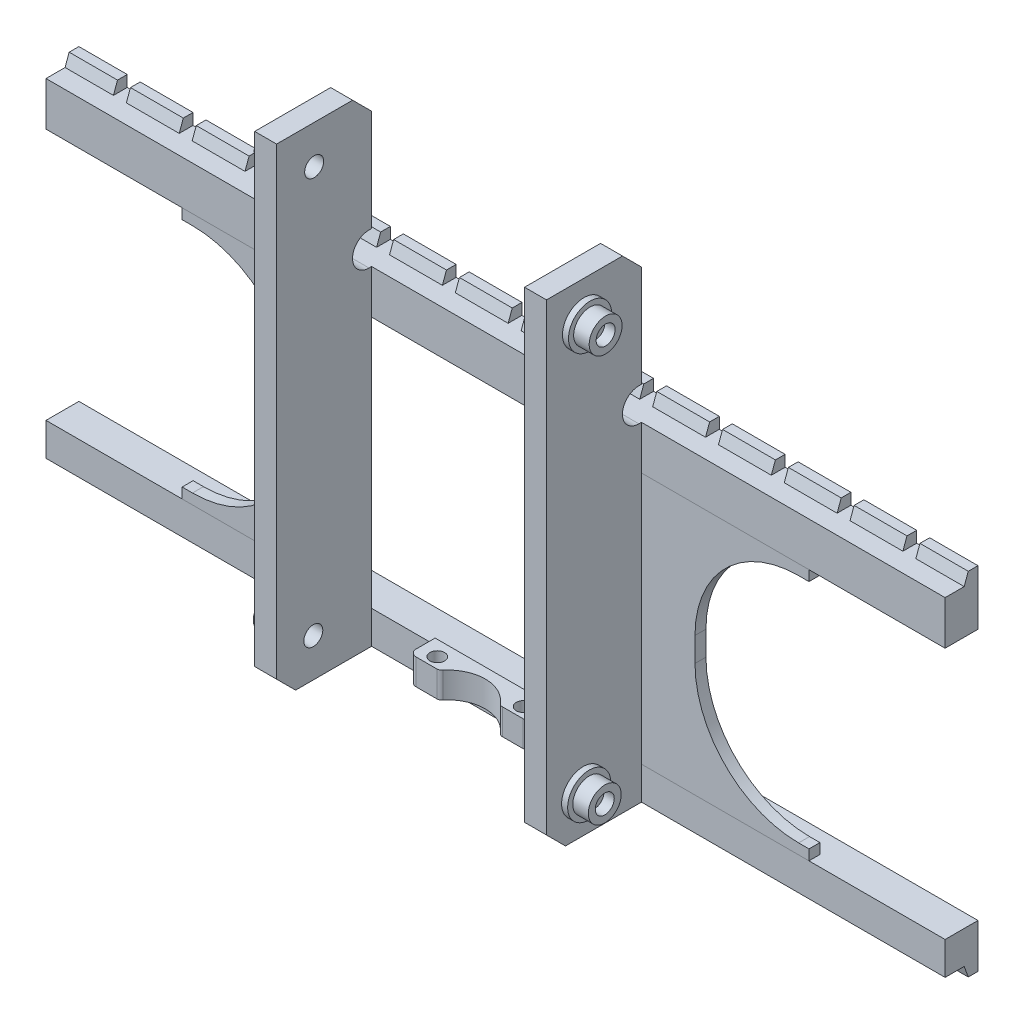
SolidWorks part; units mm, degrees
ref_plane "Front Plane" through (0, 0, 0) normal (0, 0, 1) x (1, 0, 0)
ref_plane "Top Plane" through (0, 0, 0) normal (0, 1, 0) x (1, 0, 0)
ref_plane "Right Plane" through (0, 0, 0) normal (1, 0, 0) x (0, 0, -1)
sketch "Sketch2" plane through (0, 0, 0) normal (0, 1, 0) x (1, 0, 0)
  line L0 (0, 0) -> (0, -166.4194) construction
  line L1 (143.6, 41) -> (169, 41)
  line L2 (143.6, 41) -> (143.6, 151)
  line L3 (143.6, 151) -> (169, 151)
  line L4 (169, 41) -> (169, 151)
  line L5 (-143.6, 151) -> (-169, 151)
  line L6 (-169, 41) -> (-169, 151)
  line L7 (-143.6, 41) -> (-169, 41)
  line L8 (-143.6, 41) -> (-143.6, 151)
extrude "Boss-Extrude1" add sketch "Sketch2" along normal blind 558.8
sketch "Sketch3" plane through (0, 0, 0) normal (1, 0, 0) x (0, 0, -1)
  line L0 (151, 558.8) -> (151, 0) construction
  line L1 (151, 558.8) -> (151, 0) construction
  line L2 (151, 0) -> (151, 38.1)
  line L3 (151, 38.1) -> (189.1, 38.1)
  line L4 (189.1, 38.1) -> (189.1, -13)
  line L5 (189.1, -13) -> (177.8316, -13)
  line L6 (177.8316, -13) -> (173.1, 0)
  line L7 (0, 0) -> (263.9397, 0) construction
  line L8 (173.1, 0) -> (151, 0)
  dimension "D1" = 110
  dimension "D2" = 16
  dimension "D3" = 38.1
  dimension "D4" = 13
  dimension "D5" = 38.1
extrude "Boss-Extrude2" add sketch "Sketch3" along normal mid plane 1041.4
sketch "Sketch4" plane through (0, 0, 0) normal (1, 0, 0) x (0, 0, -1)
  line L0 (151, 38.1) -> (151, 330.2)
  line L1 (151, 330.2) -> (189.1, 330.2)
  line L2 (189.1, 330.2) -> (189.1, 394)
  line L3 (189.1, 394) -> (177.8316, 394)
  line L4 (177.8316, 394) -> (173.1, 381)
  line L5 (173.1, 381) -> (151, 381)
  line L6 (151, 38.1) -> (151, 0)
  line L7 (189.1, 38.1) -> (151, 38.1)
  line L8 (189.1, -13) -> (189.1, 38.1)
  line L9 (177.8316, -13) -> (189.1, -13)
  line L10 (173.1, 0) -> (177.8316, -13)
  line L11 (151, 0) -> (173.1, 0)
  line L12 (151, 38.1) -> (151, 0) construction
  line L13 (189.1, 38.1) -> (151, 38.1) construction
  line L14 (189.1, -13) -> (189.1, 38.1) construction
  line L15 (177.8316, -13) -> (189.1, -13) construction
  line L16 (173.1, 0) -> (177.8316, -13) construction
  line L17 (151, 0) -> (173.1, 0) construction
  line L18 (151, 381) -> (151, 330.2)
  dimension "D2" = 16
  dimension "D3" = 13
  dimension "D4" = 110
  dimension "D5" = 50.8
  dimension "D6" = 381
  dimension "D1" = 0
extrude "Boss-Extrude3" add sketch "Sketch4" along normal mid plane 1041.4 contours L5 L18 L1 L2 L3 L4
sketch "Sketch5" plane through (143.6, 0, 0) normal (-1, 0, 0) x (0, 0, 1)
  line L0 (-151, 381) -> (-148, 381)
  line L1 (-148, 381) -> (-148, 400.05) construction
  line L2 (-148, 419.1) -> (-151, 419.1)
  line L3 (-151, 558.8) -> (-151, 381) construction
  line L4 (-151, 419.1) -> (-151, 381)
  arc A0 (-148, 381) -> (-148, 419.1) centre (-148, 400.05) ccw
  dimension "D1" = 3
  dimension "D2" = 19.05
extrude "Cut-Extrude1" cut sketch "Sketch5" against normal blind 30 and the other way blind 320
sketch "Sketch6" plane through (0, 0, -151) normal (0, 0, -1) x (-1, 0, 0)
  line L0 (163, 330.2) -> (363, 330.2)
  line L1 (143.6, 330.2) -> (169, 330.2) construction
  line L2 (169, 330.2) -> (520.7, 330.2) construction
  line L3 (363, 330.2) -> (363, 318.2)
  line L4 (363, 318.2) -> (351, 318.2)
  line L5 (163, 330.2) -> (163, 38.1)
  line L6 (143.6, 38.1) -> (169, 38.1) construction
  line L7 (163, 38.1) -> (363, 38.1)
  line L8 (169, 38.1) -> (520.7, 38.1) construction
  line L9 (363, 38.1) -> (363, 50.1)
  line L10 (363, 50.1) -> (351, 50.1)
  line L11 (231, 198.2) -> (231, 170.1)
  line L12 (169, 330.2) -> (169, 38.1) construction
  line L13 (0, 0) -> (0, 101.5131) construction
  line L14 (-363, 318.2) -> (-351, 318.2)
  line L15 (-363, 330.2) -> (-363, 318.2)
  line L16 (-163, 330.2) -> (-363, 330.2)
  line L17 (-163, 330.2) -> (-163, 38.1)
  line L18 (-163, 38.1) -> (-363, 38.1)
  line L19 (-363, 38.1) -> (-363, 50.1)
  line L20 (-363, 50.1) -> (-351, 50.1)
  line L21 (-231, 198.2) -> (-231, 170.1)
  arc A0 (351, 318.2) -> (231, 198.2) centre (351, 198.2) ccw
  arc A1 (351, 50.1) -> (231, 170.1) centre (351, 170.1) cw
  arc A2 (-351, 318.2) -> (-231, 198.2) centre (-351, 198.2) cw
  arc A3 (-351, 50.1) -> (-231, 170.1) centre (-351, 170.1) ccw
  dimension "D1" = 12
  dimension "D4" = 120
  dimension "D2" = 200
  dimension "D3" = 6
  dimension "D5" = 12
extrude "Boss-Extrude4" add sketch "Sketch6" along normal blind 12.7
sketch "Sketch7" plane through (0, 0, -189.1) normal (0, 0, -1) x (-1, 0, 0)
  line L0 (-520.7, 394) -> (520.7, 394) construction
  line L1 (464.7, 394) -> (449.7, 394)
  line L2 (464.7, 394) -> (464.7, 381)
  line L3 (464.7, 381) -> (449.7, 381)
  line L4 (449.7, 394) -> (449.7, 381)
  line L5 (457.2, 394) -> (457.2, 408.4838) construction
  line L6 (0, 0) -> (0, 427.4582) construction
  line L7 (388.5, 394) -> (388.5, 381)
  line L8 (388.5, 394) -> (373.5, 394)
  line L9 (373.5, 394) -> (373.5, 381)
  line L10 (388.5, 381) -> (373.5, 381)
  line L11 (312.3, 394) -> (312.3, 381)
  line L12 (312.3, 394) -> (297.3, 394)
  line L13 (297.3, 394) -> (297.3, 381)
  line L14 (312.3, 381) -> (297.3, 381)
  line L15 (236.1, 394) -> (236.1, 381)
  line L16 (236.1, 394) -> (221.1, 394)
  line L17 (221.1, 394) -> (221.1, 381)
  line L18 (236.1, 381) -> (221.1, 381)
  line L19 (159.9, 394) -> (159.9, 381)
  line L20 (159.9, 394) -> (144.9, 394)
  line L21 (144.9, 394) -> (144.9, 381)
  line L22 (159.9, 381) -> (144.9, 381)
  line L23 (83.7, 394) -> (83.7, 381)
  line L24 (83.7, 394) -> (68.7, 394)
  line L25 (68.7, 394) -> (68.7, 381)
  line L26 (83.7, 381) -> (68.7, 381)
  line L27 (7.5, 394) -> (7.5, 381)
  line L28 (7.5, 394) -> (-7.5, 394)
  line L29 (-7.5, 394) -> (-7.5, 381)
  line L30 (7.5, 381) -> (-7.5, 381)
  line L31 (-68.7, 394) -> (-68.7, 381)
  line L32 (-68.7, 394) -> (-83.7, 394)
  line L33 (-83.7, 394) -> (-83.7, 381)
  line L34 (-68.7, 381) -> (-83.7, 381)
  line L35 (-144.9, 394) -> (-144.9, 381)
  line L36 (-144.9, 394) -> (-159.9, 394)
  line L37 (-159.9, 394) -> (-159.9, 381)
  line L38 (-144.9, 381) -> (-159.9, 381)
  line L39 (-221.1, 394) -> (-221.1, 381)
  line L40 (-221.1, 394) -> (-236.1, 394)
  line L41 (-236.1, 394) -> (-236.1, 381)
  line L42 (-221.1, 381) -> (-236.1, 381)
  line L43 (-297.3, 394) -> (-297.3, 381)
  line L44 (-297.3, 394) -> (-312.3, 394)
  line L45 (-312.3, 394) -> (-312.3, 381)
  line L46 (-297.3, 381) -> (-312.3, 381)
  line L47 (-373.5, 394) -> (-373.5, 381)
  line L48 (-373.5, 394) -> (-388.5, 394)
  line L49 (-388.5, 394) -> (-388.5, 381)
  line L50 (-373.5, 381) -> (-388.5, 381)
  line L51 (-449.7, 394) -> (-449.7, 381)
  line L52 (-449.7, 394) -> (-464.7, 394)
  line L53 (-464.7, 394) -> (-464.7, 381)
  line L54 (-449.7, 381) -> (-464.7, 381)
  line L55 (-520.7, -13) -> (520.7, -13) construction
  line L56 (90, -13) -> (10, -13)
  line L57 (90, -13) -> (90, 0)
  line L58 (90, 0) -> (10, 0)
  line L59 (10, -13) -> (10, 0)
  dimension "D1" = 13
  dimension "D2" = 15
  dimension "D3" = 457.2
  dimension "D5" = 13
  dimension "D6" = 80
  dimension "D7" = 10
  dimension "D4" = 13
extrude "Cut-Extrude2" cut sketch "Sketch7" against normal blind 25
sketch "Sketch8" plane through (169, 0, 0) normal (1, 0, 0) x (0, 0, -1)
  line L0 (123, 0) -> (45, 0) construction
  line L1 (123, 0) -> (45, 0) construction
  line L2 (84, 0) -> (84, 558.8) construction
  line L3 (83.5, 0) -> (83.5, 44.45) construction
  line L5 (41, 558.8) -> (151, 558.8) construction
  line L6 (84.5, 558.8) -> (84.5, 514.35) construction
  circle A0 centre (83.5, 44.45) radius 19.05
  circle A1 centre (84.5, 514.35) radius 19.05
  point P13 (89.8516, 508)
  dimension "D5" = 38.1
  dimension "D2" = 0.5
  dimension "D3" = 44.45
  dimension "D4" = 0.5
  dimension "D6" = 44.45
extrude "Boss-Extrude5" add sketch "Sketch8" against normal up to surface (25 mm away) from offset 25 separate body
sketch "Sketch12" plane through (169, 0, 0) normal (-1, 0, 0) x (0, 0, 1)
  circle A0 centre (-84.5, 514.35) radius 25
  circle A1 centre (-83.5, 44.45) radius 25
  dimension "D1" = 50
  dimension "D2" = 50
extrude "Boss-Extrude9" add sketch "Sketch12" against normal blind 7
sketch "Sketch13" plane through (194, 0, 0) normal (1, 0, 0) x (0, 0, -1)
  circle A0 centre (84.5, 514.35) radius 11
  circle A1 centre (83.5, 44.45) radius 11
  dimension "D1" = 22
  dimension "D2" = 22
extrude "Cut-Extrude3" cut sketch "Sketch13" against normal blind 12
sketch "Sketch14" plane through (182, 0, 0) normal (1, 0, 0) x (0, 0, -1)
  circle A0 centre (84.5, 514.35) radius 6
  circle A1 centre (83.5, 44.45) radius 6
  dimension "D1" = 12
  dimension "D2" = 12
extrude "Cut-Extrude4" cut sketch "Sketch14" against normal up to next (13 mm away)
mirror "Mirror1" about plane through (0, 0, 0) normal (1, 0, 0)
chamfer "Chamfer1" distance 22 angle 45 2 edges at (-156.3, 558.8, -151) (156.3, 558.8, -151)
sketch "Sketch15" plane through (169, 0, 0) normal (1, 0, 0) x (0, 0, -1)
  circle A0 centre (84.5, 514.35) radius 11 construction
  circle A1 centre (84.5, 514.35) radius 11
  circle A2 centre (83.5, 44.45) radius 11 construction
  circle A3 centre (83.5, 44.45) radius 11
extrude "Cut-Extrude5" cut sketch "Sketch15" against normal up to surface (338 mm away)
combine bodies "Combine1" operation type add bodies to combine 126 125 116 117 127
sketch "Sketch16" plane through (0, 0, -151) normal (0, 0, 1) x (1, 0, 0)
  line L1 (-363, 330.2) -> (363, 330.2)
  line L2 (-363, 330.2) -> (-363, 38.1)
  line L3 (-363, 38.1) -> (363, 38.1)
  line L4 (363, 330.2) -> (363, 38.1)
sketch "Sketch17" plane through (0, 381, 0) normal (0, 1, 0) x (1, 0, 0)
  line L0 (520.7, 151) -> (169, 151) construction
  line L1 (168, 151) -> (144.6, 151)
  line L2 (168, 151) -> (168, 150.5)
  line L3 (168, 150.5) -> (144.6, 150.5)
  line L4 (144.6, 151) -> (144.6, 150.5)
  line L5 (169, 148) -> (169, 151) construction
  line L6 (143.6, 151) -> (143.6, 148) construction
  line L7 (-169, 151) -> (-520.7, 151) construction
  line L8 (-168, 151) -> (-144.6, 151)
  line L9 (-168, 151) -> (-168, 150.5)
  line L10 (-168, 150.5) -> (-144.6, 150.5)
  line L11 (-144.6, 151) -> (-144.6, 150.5)
  line L12 (-169, 151) -> (-169, 148) construction
  line L13 (-143.6, 148) -> (-143.6, 151) construction
  dimension "D1" = 1
  dimension "D2" = 1
  dimension "D3" = 0.5
  dimension "D4" = 1
  dimension "D5" = 1
  dimension "D6" = 0.5
extrude "Cut-Extrude6" [suppressed] cut sketch "Sketch17" against normal offset from surface (49.8 mm away) 1
sketch "Sketch18" plane through (-363, 0, 0) normal (-1, 0, 0) x (0, 0, 1)
  line L0 (-163.7, 38.1) -> (-151, 38.1) construction
  line L1 (-162.7, 38.1) -> (-157.5, 38.1)
  line L2 (-162.7, 38.1) -> (-162.7, 38.6)
  line L3 (-162.7, 38.6) -> (-157.5, 38.6)
  line L4 (-157.5, 38.1) -> (-157.5, 38.6)
  line L5 (-163.7, 38.1) -> (-163.7, 50.1) construction
  line L6 (-151, 38.1) -> (-151, 50.1) construction
  line L7 (-163.7, 330.2) -> (-151, 330.2) construction
  line L8 (-162.7, 330.2) -> (-157.5, 330.2)
  line L9 (-162.7, 330.2) -> (-162.7, 329.7)
  line L10 (-162.7, 329.7) -> (-157.5, 329.7)
  line L11 (-157.5, 330.2) -> (-157.5, 329.7)
  line L12 (-163.7, 318.2) -> (-163.7, 330.2) construction
  line L13 (-151, 318.2) -> (-151, 330.2) construction
  dimension "D1" = 1
  dimension "D2" = 6.5
  dimension "D3" = 0.5
  dimension "D4" = 1
  dimension "D5" = 6.5
  dimension "D6" = 0.5
extrude "Cut-Extrude7" [suppressed] cut sketch "Sketch18" against normal through all
sketch "Sketch19" plane through (-169, 0, 0) normal (-1, 0, 0) x (0, 0, 1)
  circle A3 centre (-84.5, 514.35) radius 24
  circle A4 centre (-84.5, 514.35) radius 24
  circle A6 centre (-83.5, 44.45) radius 24
  circle A7 centre (-83.5, 44.45) radius 24
  dimension "D1" = 1
  dimension "D2" = 1
extrude "Cut-Extrude8" [suppressed] cut sketch "Sketch19" along normal blind 0.5
sketch "Sketch22" plane through (0, 0, 0) normal (0, -1, 0) x (1, 0, 0)
  line L4 (-168, -151) -> (-144.6, -151)
  line L5 (-144.6, -151) -> (-144.6, -150.5)
  line L6 (-144.6, -150.5) -> (-168, -150.5)
  line L7 (-168, -150.5) -> (-168, -151)
  line L8 (-168, -151) -> (-144.6, -151)
  line L9 (-144.6, -151) -> (-144.6, -150.5)
  line L10 (-144.6, -150.5) -> (-168, -150.5)
  line L11 (-168, -150.5) -> (-168, -151)
  line L12 (144.6, -151) -> (168, -151)
  line L13 (144.6, -150.5) -> (144.6, -151)
  line L14 (168, -150.5) -> (144.6, -150.5)
  line L15 (168, -151) -> (168, -150.5)
  line L16 (144.6, -151) -> (168, -151)
  line L17 (144.6, -150.5) -> (144.6, -151)
  line L18 (168, -150.5) -> (144.6, -150.5)
  line L19 (168, -151) -> (168, -150.5)
  dimension "D1" = 0
  dimension "D2" = 0
extrude "Cut-Extrude10" [suppressed] cut sketch "Sketch22" against normal offset from surface (37.1 mm away) 1
sketch "Sketch20" plane through (169, 0, 0) normal (1, 0, 0) x (0, 0, -1)
  circle A1 centre (83.5, 44.45) radius 24
  circle A2 centre (83.5, 44.45) radius 24
  circle A3 centre (84.5, 514.35) radius 24
  circle A4 centre (84.5, 514.35) radius 24
  dimension "D1" = 0
  dimension "D2" = 0
extrude "Cut-Extrude9" [suppressed] cut sketch "Sketch20" along normal blind 0.5
chamfer "Chamfer2" distance 22 angle 45 2 edges at (156.3, 0, -41) (-156.3, 0, -41)
chamfer "Chamfer3" [suppressed] distance 12 angle 45
chamfer "Chamfer4" [suppressed] distance 8 angle 45
chamfer "Chamfer5" [suppressed] distance 6 angle 45
chamfer "Chamfer6" [suppressed] distance 6 angle 45
chamfer "Chamfer8" [suppressed] distance 6 angle 45
sketch "Sketch23" plane through (0, 38.1, 0) normal (0, 1, 0) x (1, 0, 0)
  line L0 (-70, 151) -> (-70, 121)
  line L1 (143.6, 151) -> (-143.6, 151) construction
  line L2 (-70, 121) -> (-34.9857, 121)
  line L3 (-34.9857, 121) -> (0, 121) construction
  line L4 (0, 0) -> (0, 263.9397) construction
  line L5 (0, 121) -> (0, 151) construction
  line L6 (0, 121) -> (0, 96) construction
  line L7 (34.9857, 121) -> (70, 121)
  line L8 (70, 121) -> (70, 151)
  line L9 (143.6, 151) -> (0, 151) construction
  line L10 (70, 151) -> (0, 151)
  line L11 (0, 151) -> (-70, 151)
  line L12 (-50, 133.5) -> (-50, 151) construction
  arc A0 (-34.9857, 121) -> (34.9857, 121) centre (0, 96) cw
  circle A1 centre (-50, 133.5) radius 8.5
  circle A2 centre (50, 133.5) radius 8.5
  dimension "D1" = 30
  dimension "D3" = 43
  dimension "D5" = 50
  dimension "D7" = 17
  dimension "D2" = 70
  dimension "D4" = 55
  dimension "D6" = 17.5
extrude "Boss-Extrude10" add sketch "Sketch23" along normal blind 7 and the other way blind 23
fillet "Fillet1" radius 8 2 edges at (70, 30.1, -121) (-70, 30.1, -121)
fillet "Fillet2" radius 6 2 edges at (34.9857, 30.1, -121) (-34.9857, 30.1, -121)
chamfer "Chamfer9" [suppressed] distance 6 angle 45
chamfer "Chamfer10" [suppressed] distance 6 angle 45
chamfer "Chamfer11" [suppressed] distance 6 angle 45
chamfer "Chamfer12" [suppressed] distance 6 angle 45
chamfer "Chamfer13" [suppressed] distance 6 angle 45
chamfer "Chamfer14" [suppressed] distance 6 angle 45
